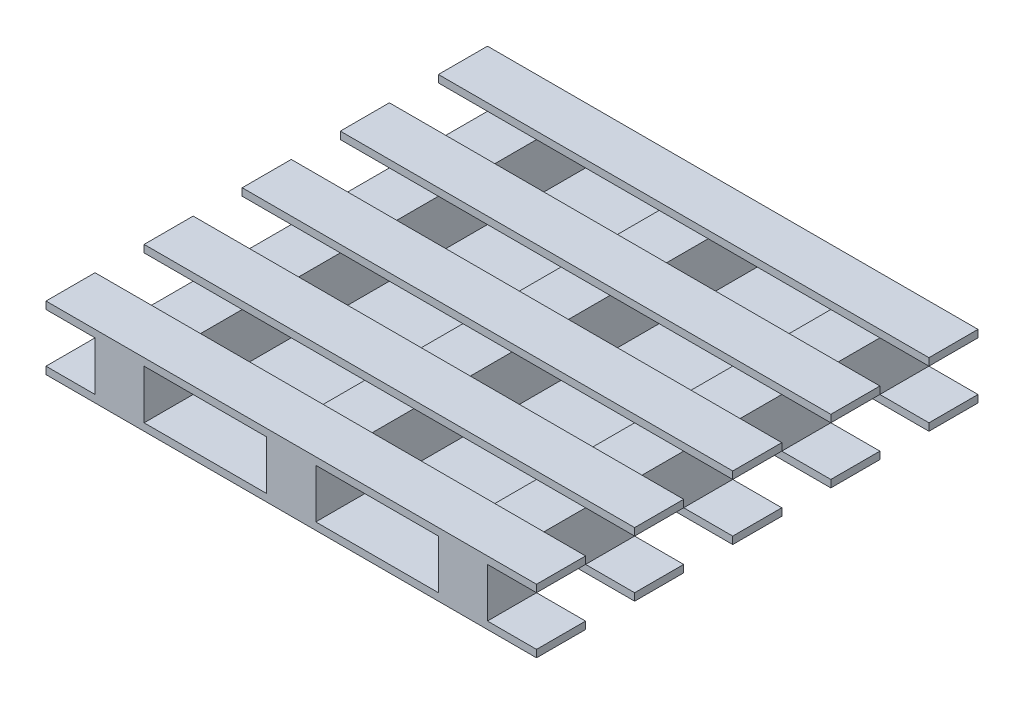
SolidWorks part; units mm, degrees
ref_plane "Plan de face" through (0, 0, 0) normal (0, 0, 1) x (1, 0, 0)
ref_plane "Plan de dessus" through (0, 0, 0) normal (0, 1, 0) x (1, 0, 0)
ref_plane "Plan de droite" through (0, 0, 0) normal (1, 0, 0) x (0, 0, -1)
sketch "Esquisse1" plane through (0, 0, 0) normal (0, 1, 0) x (1, 0, 0)
  line L0 (0, 0) -> (500, 0) construction
  line L1 (-500, -450) -> (500, -450)
  line L2 (-500, -450) -> (-500, 450)
  line L3 (-500, 450) -> (500, 450)
  line L4 (500, -450) -> (500, 450)
  line L5 (0, 0) -> (0, 450) construction
  dimension "D1" = 900
  dimension "D2" = 1000
extrude "Boss.-Extru.1" add sketch "Esquisse1" along normal blind 15
sketch "Esquisse2" plane through (0, 15, 0) normal (0, 1, 0) x (1, 0, 0)
  line L0 (500, 450) -> (-500, 450) construction
  line L1 (-400, 450) -> (-300, 450)
  line L2 (-400, 450) -> (-400, -450)
  line L3 (-400, -450) -> (-300, -450)
  line L4 (-300, 450) -> (-300, -450)
  line L5 (-500, -450) -> (500, -450) construction
  line L6 (-500, 0) -> (-400, 0) construction
  line L7 (-50, 450) -> (50, 450)
  line L8 (-50, 450) -> (-50, -450)
  line L9 (-50, -450) -> (50, -450)
  line L10 (50, 450) -> (50, -450)
  line L11 (300, 450) -> (400, 450)
  line L12 (300, 450) -> (300, -450)
  line L13 (300, -450) -> (400, -450)
  line L14 (400, 450) -> (400, -450)
  line L15 (-500, 450) -> (-500, -450) construction
  line L16 (-300, 0) -> (-50, 0) construction
  line L17 (50, 0) -> (300, 0) construction
  line L18 (400, 0) -> (500, 0) construction
  line L19 (500, -450) -> (500, 450) construction
  dimension "D1" = 100
  dimension "D2" = 100
extrude "Boss.-Extru.2" add sketch "Esquisse2" along normal blind 100
sketch "Esquisse3" plane through (0, 115, 0) normal (0, 1, 0) x (1, 0, 0)
  line L4 (-500, 450) -> (-500, -450)
  line L5 (500, 450) -> (-500, 450)
  line L6 (500, -450) -> (500, 450)
  line L7 (-500, -450) -> (500, -450)
  line L8 (-500, 450) -> (-500, -450)
  line L9 (500, 450) -> (-500, 450)
  line L10 (500, -450) -> (500, 450)
  line L11 (-500, -450) -> (500, -450)
  dimension "D1" = 0
extrude "Boss.-Extru.3" add sketch "Esquisse3" along normal blind 15
sketch "Esquisse4" plane through (0, 130, 0) normal (0, 1, 0) x (1, 0, 0)
  line L0 (-500, 450) -> (-500, -450) construction
  line L1 (-500, -350) -> (500, -350)
  line L2 (-500, -350) -> (-500, -250)
  line L3 (-500, -250) -> (500, -250)
  line L4 (500, -350) -> (500, -250)
  line L5 (500, -450) -> (500, 450) construction
  line L6 (-500, -450) -> (500, -450) construction
  dimension "D1" = 100
  dimension "D2" = 100
extrude "Enlèv. mat.-Extru.1" cut sketch "Esquisse4" against normal blind 15
sketch "Esquisse5" plane through (0, 0, 0) normal (0, -1, 0) x (1, 0, 0)
  line L0 (-500, 350) -> (500, 350) construction
  line L1 (500, 250) -> (-500, 250) construction
  line L2 (-500, 350) -> (500, 350)
  line L3 (500, 250) -> (-500, 250)
  line L4 (-500, 350) -> (-500, 250)
  line L5 (500, 350) -> (500, 250)
extrude "Enlèv. mat.-Extru.2" cut sketch "Esquisse5" against normal blind 15
pattern_linear "Répétition linéaire1" count 4 spacing 200 along (0, 0, -1) of "Enlèv. mat.-Extru.2", "Enlèv. mat.-Extru.1"
